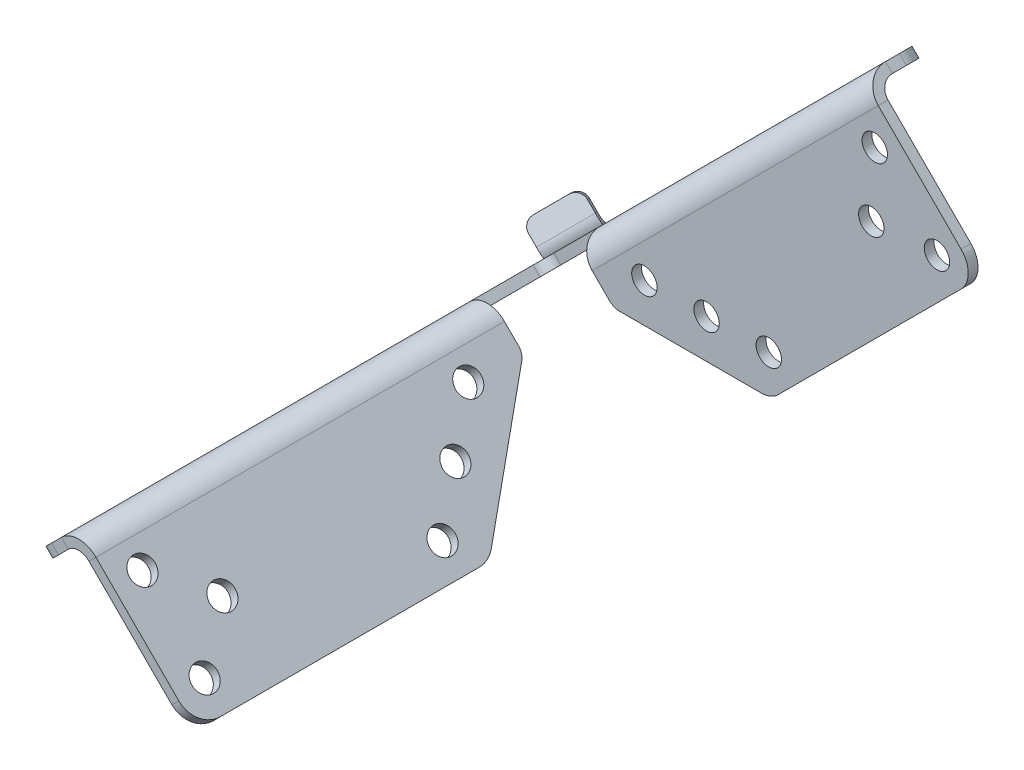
SolidWorks part; units mm, degrees
ref_plane "Ebene vorne" through (0, 0, 0) normal (0, 0, 1) x (1, 0, 0)
ref_plane "Ebene oben" through (0, 0, 0) normal (0, 1, 0) x (1, 0, 0)
ref_plane "Ebene rechts" through (0, 0, 0) normal (1, 0, 0) x (0, 0, -1)
sketch "Skizze1" plane through (0, 0, 0) normal (0, 0, 1) x (1, 0, 0)
  line L0 (0, 45.7332) -> (0, -59.2365) construction
  line L1 (-63.0609, 0) -> (82.8079, 0) construction
  line L2 (-18.9757, 32.132) -> (-74.6249, -62.7279)
  line L3 (-2.5, 0) -> (-2.5, -50)
  line L4 (-2.5, -50) -> (-44.9264, -92.4264)
  line L5 (-2.5, -50) -> (2.5, -50) construction
  line L6 (-44.9264, -92.4264) -> (-74.6249, -62.7279)
  line L7 (-2.5, 0) -> (0.2958, 0) construction
  line L8 (44.9264, -92.4264) -> (74.6249, -62.7279)
  line L9 (2.5, -50) -> (44.9264, -92.4264)
  line L10 (2.5, 0) -> (2.5, -50)
  line L11 (18.9757, 32.132) -> (74.6249, -62.7279)
  arc A0 (18.9757, 32.132) -> (-18.9757, 32.132) centre (0, 21) ccw
  arc A1 (2.5, 0) -> (-2.5, 0) centre (0, 0) ccw
  dimension "D2" = 22
  dimension "D1" = 45
  dimension "D3" = 21
  dimension "D4" = 5
  dimension "D5" = 50
  dimension "D6" = 42
  dimension "D7" = 60
  dimension "D8" = 45
  dimension "D9" = 42
  dimension "D10" = 60
  dimension "D11" = 109.9784
  dimension "D12" = 109.9784
sheet metal parameters "Blech2" thickness 2 parameters "D1"=3, "Dicke"=2
base flange "Basis-Blech1" sketch "Skizze1" thickness 2 reverse thickness direction yes parameters "D1"=3
sketch "Skizze13" plane through (0, 0, 2) normal (0, 0, 1) x (1, 0, 0)
  line L0 (0, -83.1062) -> (0, 50.9856) construction
  line L1 (0, -39.0147) -> (-53.8856, -92.9003) construction
  line L2 (-44.9264, -83.9411) -> (-57.6543, -71.2132) construction
  line L3 (-57.6543, -71.2132) -> (1.7374, -11.8215) construction
  line L4 (-44.9264, -92.4264) -> (-2.5, -50) construction
  line L5 (-51.2904, -77.5772) -> (-0.6043, -26.8911) construction
  line L6 (-2.5, -50) -> (-2.5, 0) construction
  line L7 (-10.5, -24.0589) -> (-10.5, -49.5147) construction
  line L8 (-74.6249, -62.7279) -> (-44.9264, -92.4264) construction
  circle A0 centre (-57.6543, -71.2132) radius 2.6
  circle A1 centre (-44.9264, -83.9411) radius 2.6
  circle A2 centre (-44.2193, -70.5061) radius 2.6
  circle A3 centre (-10.5, -36.7868) radius 2.6
  circle A4 centre (-10.5, -24.0589) radius 2.6
  circle A5 centre (-10.5, -49.5147) radius 2.6
  circle A6 centre (57.6543, -71.2132) radius 2.6
  circle A7 centre (10.5, -49.5147) radius 2.6
  circle A8 centre (10.5, -24.0589) radius 2.6
  circle A9 centre (10.5, -36.7868) radius 2.6
  circle A10 centre (44.2193, -70.5061) radius 2.6
  circle A11 centre (44.9264, -83.9411) radius 2.6
  dimension "D3" = 5.2
  dimension "D1" = 18
  dimension "D2" = 6
  dimension "D4" = 10
  dimension "D5" = 6
  dimension "D6" = 8
extrude "Bohrungen Befestigung Modul" cut sketch "Skizze13" against normal blind 10
sketch "Skizze8" plane through (0, 0, 0) normal (0, 0, -1) x (-1, 0, 0)
  line L0 (-2.5, -4.7627) -> (-67.545, -69.8078)
  line L1 (-2.5, 0) -> (-2.5, -50) construction
  line L2 (-44.9264, -92.4264) -> (-74.6249, -62.7279) construction
  line L3 (-2.5, -50) -> (-44.9264, -92.4264) construction
  dimension "D1" = 1.6
sketched bend "Skizzierte Biegung7" parameters "D1"=3
bend "Skizzenbiegung6" bend radius 3 bend angle 90 parameters "D5"=1
sketch "Skizze9" plane through (-1.1314, -1.1314, 0) normal (-0.7071, -0.7071, 0) x (0, 0, 1)
  line L0 (3.8187, -1.6) -> (95.8063, -1.6)
  line L1 (35.8063, -33.5876) -> (0.451, 1.7678) construction
  line L3 (95.8063, 8.4124) -> (95.8063, -33.5876) construction
  line L5 (95.8063, -33.5876) -> (35.8063, -33.5876) construction
  dimension "D1" = 1.6
sketched bend "Skizzierte Biegung8" parameters "D1"=3
bend "Skizzenbiegung7" bend radius 3 bend angle 90 parameters "D5"=2
sketch "Skizze18" plane through (-0.2828, 0.2828, 0) normal (-0.7071, 0.7071, 0) x (0, 0, 1)
  line L0 (-3.8168, -2.9168) -> (-3.8168, 11.4)
  line L1 (-3.8168, 11.4) -> (12.1832, 11.4)
  line L2 (-1.3168, -5.4168) -> (12.1832, -5.4168)
  line L3 (12.1832, -5.4168) -> (12.1832, 11.4)
  line L5 (-3, -1.0645) -> (-3.0003, 94.2063) construction
  line L6 (0.5355, -4.6) -> (95.8063, -4.5997) construction
  arc A0 (-3.0846, -1.1491) -> (0.451, -4.6846) centre (-1.3168, -2.9168) ccw construction
  arc A1 (-3.8168, -2.9168) -> (-1.3168, -5.4168) centre (-1.3168, -2.9168) ccw
  dimension "D1" = 16
  dimension "D2" = 16
extrude "Linear austragen3" cut sketch "Skizze18" against normal blind 27
fillet "Verrundung4" radius 3 2 edges at (15.6845, 0.4375, 1) (6.6217, -7.4702, 12.1832)
sketch "Skizze10" plane through (-0.2828, 0.2828, 0) normal (-0.7071, 0.7071, 0) x (0, 0, -1)
  circle A0 centre (16.1661, 17.7661) radius 10.25
  dimension "D1" = 20.5
extrude "Bohrung" cut sketch "Skizze10" against normal blind 32
fillet "Verrundung1" radius 5 6 edges at (-7.5867, -8.4352, 95.8063) (23.3257, -24.1743, 95.8063) (23.3257, -24.1743, 35.8063) (47.9375, 0.4375, 1) (90.3639, 42.8639, 1) (67.0382, 66.1896, -9.7292)
sketch "Skizze12" plane through (-0.2828, 0.2828, 0) normal (-0.7071, 0.7071, 0) x (0, 0, -1)
  line L0 (16.1661, 17.7661) -> (-49.7168, -48.1168) construction
  line L1 (16.1661, 17.7661) -> (16.1661, -33.8732) construction
  line L2 (16.1661, 17.7661) -> (-8.7356, 42.6677) construction
  circle A0 centre (16.1661, -6.9827) radius 2.6
  circle A1 centre (-8.5827, 17.7661) radius 2.6
  dimension "D2" = 5.2
  dimension "D1" = 45
  dimension "D3" = 35
extrude "Bohrungen Federsplint" cut sketch "Skizze12" against normal blind 32
sketch "Skizze15" plane through (-0.2828, 0.2828, 0) normal (-0.7071, 0.7071, 0) x (0, 0, 1)
  line L0 (-16.166, -17.7661) -> (-36.1301, -37.7302) construction
  line L1 (-30.1314, -24.6604) -> (-30.8385, -23.9533)
  line L2 (-30.1314, -24.6604) -> (-15.7541, -10.2831)
  line L3 (-30.8385, -23.9533) -> (-16.4612, -9.576)
  line L4 (-15.7541, -10.2831) -> (-16.4612, -9.576)
  line L5 (-30.1314, -24.6604) -> (-16.4612, -9.576) construction
  line L6 (-30.8385, -23.9533) -> (-15.7541, -10.2831) construction
  line L7 (-16.166, -17.7661) -> (-16.166, -51.8906) construction
  line L8 (-8.683, -17.3542) -> (-7.9759, -18.0613)
  line L9 (-22.3532, -32.4386) -> (-7.9759, -18.0613)
  line L10 (-23.0603, -31.7315) -> (-8.683, -17.3542)
  line L11 (-23.0603, -31.7315) -> (-22.3532, -32.4386)
  circle A0 centre (-16.166, -17.7661) radius 10.25 construction
  point P4 (-23.2963, -17.1182)
  point P11 (-15.5181, -24.8964)
  dimension "D1" = 45
  dimension "D2" = 1
  dimension "D3" = 10
  dimension "D4" = 4.5
extrude "Schnitt Lasche innen" cut sketch "Skizze15" against normal blind 10
sketch "Skizze16" plane through (-0.2828, 0.2828, 0) normal (-0.7071, 0.7071, 0) x (0, 0, 1)
  line L0 (-26.0286, -20.5576) -> (-23.0603, -17.5893)
  line L1 (-18.9575, -27.6287) -> (-15.9892, -24.6604)
  line L2 (-15.9892, -24.6604) -> (-23.0603, -17.5893)
  line L3 (-30.1314, -24.6604) -> (-26.0286, -20.5576) construction
  line L4 (-30.8385, -23.9533) -> (-30.1314, -24.6604) construction
  arc A0 (-26.0286, -20.5576) -> (-18.9575, -27.6287) centre (-16.166, -17.7661) ccw construction
  arc A1 (-26.0286, -20.5576) -> (-18.9575, -27.6287) centre (-16.166, -17.7661) ccw
  dimension "D1" = 10
extrude "Linear austragen2" add sketch "Skizze16" against normal up to surface (2 mm away)
sketch "Skizze17" plane through (-0.2828, 0.2828, 0) normal (-0.7071, 0.7071, 0) x (0, 0, 1)
  line L0 (-22.3532, -31.0244) -> (-29.4243, -23.9533)
  line L3 (-15.9892, -24.6604) -> (-23.0603, -31.7315) construction
  line L4 (-30.1314, -24.6604) -> (-23.0603, -17.5893) construction
  line L5 (-15.9892, -24.6604) -> (-23.0603, -17.5893) construction
  line L6 (-23.0603, -31.7315) -> (-22.3532, -32.4386) construction
  dimension "D1" = 1
sketched bend "Skizzierte Biegung10" parameters "D1"=2
bend "Skizzenbiegung9" bend radius 2 bend angle 90 parameters "D5"=3
fillet "Verrundung2" radius 2 2 edges at (-20.1663, -10.7086, -27.303) (-25.1663, -15.7086, -20.232)
fillet "Verrundung3" radius 3 2 edges at (-19.2934, -20.142, -17.7998) (-13.2934, -14.1419, -26.285)
flat pattern "Abwicklung2"
sketch "Biegung-Linien2" plane through (-0.2828, 0.2828, 0) normal (-0.7071, 0.7071, 0) x (0, 0, 1)
  line L0 (-27.7582, -22.2871) -> (-20.6872, -29.3582) construction
  line L1 (95.8063, -1.4584) -> (12.1832, -1.4584) construction
  line L2 (0.1416, 94.2063) -> (0.1416, 11.4) construction
  line L3 (-27.7582, -22.2871) -> (-20.6872, -29.3582) construction
  line L4 (95.8063, -1.4584) -> (12.1832, -1.4584) construction
  line L5 (0.1416, 94.2063) -> (0.1416, 11.4) construction
bend of the flat pattern "Abwickeln-<Skizzenbiegung6>1"
bend of the flat pattern "Abwickeln-<Skizzenbiegung7>1"
bend of the flat pattern "Abwickeln-<Skizzenbiegung9>1"
